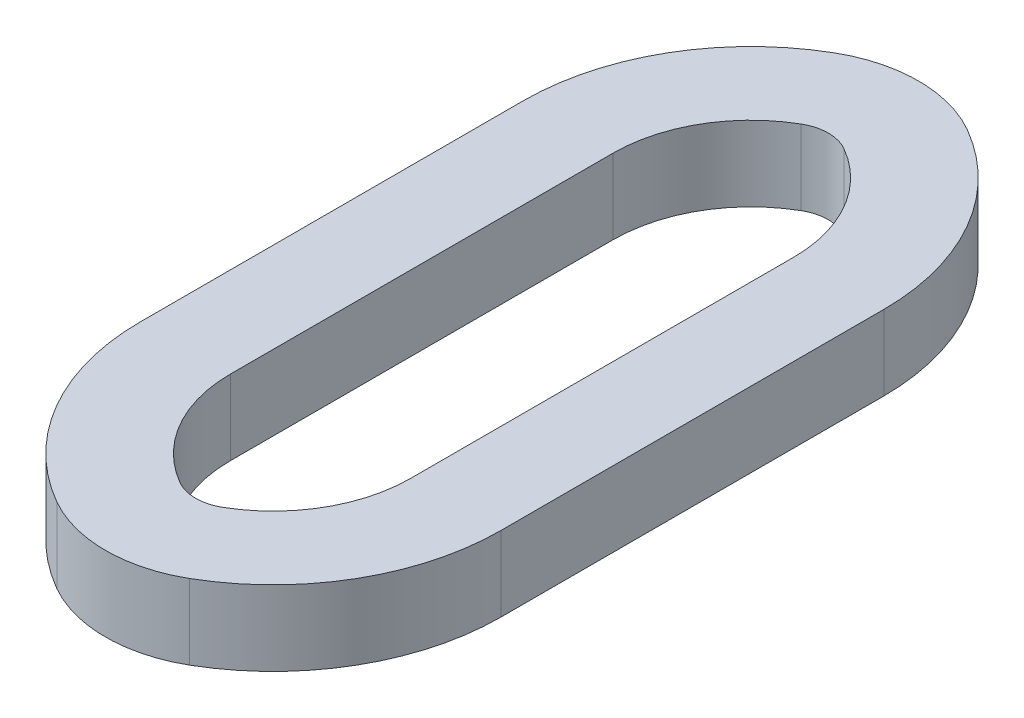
SolidWorks part; units mm, degrees
other "<6021_upper_plate>-<Fillet5>"
ref_plane "X_Y" through (0, 0, 0) normal (0, 0, 1) x (1, 0, 0)
ref_plane "Z_X" through (0, 0, 0) normal (0, 1, 0) x (1, 0, 0)
ref_plane "Y_Z" through (0, 0, 0) normal (1, 0, 0) x (0, 0, -1)
ref_plane "X_Y-6021_upper_plate" through (0, 0, 0) normal (0, 0, 1) x (1, 0, 0)
ref_plane "Z_X-6021_upper_plate" through (0, 0, 0) normal (0, 1, 0) x (1, 0, 0)
ref_plane "Y_Z-6021_upper_plate" through (0, 0, 0) normal (1, 0, 0) x (0, 0, -1)
ref_plane "X_Y-_6021_master-6021_upper_plate" through (0, 0, 0) normal (0, 0, 1) x (1, 0, 0)
ref_plane "Z_X_peltier-_6021_master-6021_upper_plate" through (0, 0, 0) normal (0, 1, 0) x (1, 0, 0)
ref_plane "Y_Z-_6021_master-6021_upper_plate" through (0, 0, 0) normal (1, 0, 0) x (0, 0, -1)
sketch "zx_sketch-_6021_master-6021_upper_plate" plane through (0, 0, 0) normal (0, 1, 0) x (1, 0, 0)
  line L0 (0, 0) -> (0, 39833.2138) construction
  line L1 (-56.5, 24.66) -> (4, 24.66)
  line L2 (-56.5, 24.66) -> (-56.5, -27)
  line L3 (-56.5, -27) -> (56.5, -27)
  line L4 (56.5, 27) -> (56.5, -27)
  line L5 (0, 0) -> (39833.2138, 0) construction
  line L6 (4, 24.66) -> (4, 27)
  line L11 (4, 27) -> (56.5, 27)
  point P3 (0, -27)
  point P17 (-22.5, 15.66)
  point P18 (22.5, 15.66)
  point P19 (22.5, -15.66)
  point P20 (-22.5, -15.66)
  dimension "D1" = 113
  dimension "D2" = 24.66
  dimension "D3" = 45
  dimension "D4" = 31.32
  dimension "D5" = 27
  dimension "D6" = 2.34
  dimension "D7" = 4
  dimension "D8" = 27
sketch "xy_sketch-_6021_master-6021_upper_plate" plane through (0, 0, 0) normal (0, 0, 1) x (1, 0, 0)
  line L0 (0, 0) -> (0, 5) construction
  line L1 (0, 5) -> (0, 7.3) construction
  dimension "D1" = 5
  dimension "D2" = 2.3
ref_plane "zx_lower_plate-_6021_master-6021_upper_plate" through (0, 5, 0) normal (0, 1, 0) x (1, 0, 0)
ref_plane "zx_sensor-_6021_master-6021_upper_plate" through (0, 7.3, 0) normal (0, 1, 0) x (1, 0, 0)
sketch "zx_sensor_sketch-_6021_master-6021_upper_plate" plane through (0, 7.3, 0) normal (0, 1, 0) x (1, 0, 0)
  line L0 (-42.2, 3.16) -> (-28.2, 8.66) construction
  line L1 (-28.2, 8.66) -> (-14.2, 3.16) construction
  line L2 (-14.2, 3.16) -> (-0.2, 8.66) construction
  line L3 (-42.2, 4.96) -> (-42.2, -0.8) construction
  line L4 (-28.2, 10.46) -> (-28.2, 4.7) construction
  line L5 (-14.2, 4.96) -> (-14.2, -0.8) construction
  line L6 (-0.2, 10.46) -> (-0.2, 4.7) construction
  line L7 (-42.2, 3.16) -> (-42.2, -0.8) construction
  line L8 (-28.2, 8.66) -> (-28.2, 4.7) construction
  line L9 (-14.2, 3.16) -> (-14.2, -0.8) construction
  line L10 (-0.2, 8.66) -> (-0.2, 4.7) construction
  line L11 (-39.215, 3.16) -> (-45.185, 3.16) construction
  line L12 (-39.215, 7.475) -> (-39.215, -1.155) construction
  line L13 (-44.615, 3.16) -> (-39.785, 3.16) construction
  point P8 (-42.2, 2.08)
  point P16 (-42.2, 3.16)
  point P19 (-39.215, 3.16)
  point P22 (-42.2, 3.16)
  dimension "D3" = 14
  dimension "D4" = 1.08
  dimension "D6" = 5.76
  dimension "D7" = 5.97
  dimension "D9" = 8.63
  dimension "D10" = 4.83
  dimension "D11" = 5.5
sketch "zx_valve_sketch-_6021_master-6021_upper_plate" plane through (0, 8.2, 0) normal (0, 1, 0) x (1, 0, 0)
  line L0 (44, -4.25) -> (34, -4.25) construction
  line L1 (34, -4.25) -> (24, -4.25) construction
  line L2 (24, -4.25) -> (14, -4.25) construction
  line L3 (44, -10.5) -> (44, -6.5) construction
  line L4 (44, -6.5) -> (44, -2.5) construction
  line L5 (34, -2.5) -> (34, -6.5) construction
  line L6 (34, -6.5) -> (34, -10.5) construction
  line L7 (24, -2.5) -> (24, -6.5) construction
  line L8 (24, -6.5) -> (24, -10.5) construction
  line L9 (14, -2.5) -> (14, -6.5) construction
  line L10 (14, -6.5) -> (14, -10.5) construction
  line L11 (44, 10.5) -> (44, -19) construction
  line L12 (34, 10.5) -> (34, -19) construction
  line L14 (24, -19) -> (24, 10.5) construction
  line L17 (14, 10.5) -> (14, -19) construction
  point P20 (44, -4.25)
  dimension "D1" = 10
  dimension "D4" = 8
  dimension "D5" = 2.25
  dimension "D6" = 29.5
sketch "zx_manifold_sketch-_6021_master-6021_upper_plate" plane through (0, 5, 0) normal (0, 1, 0) x (1, 0, 0)
  line L0 (-34.0003, 7.58) -> (-22.3997, 7.58) construction
  line L4 (44, 19.5) -> (34, 19.5) construction
  line L5 (34, 19.5) -> (24, 19.5) construction
  line L6 (24, 19.5) -> (14, 19.5) construction
  line L7 (39, 10.5) -> (39, -7.6132)
  line L9 (-48.0003, 2.08) -> (-36.3997, 2.08) construction
  line L11 (-20.0003, 2.08) -> (-8.3997, 2.08) construction
  line L12 (-6.0003, 7.58) -> (5.6003, 7.58) construction
  line L13 (-48.9, -6.72) -> (-2.2958, -6.72)
  line L15 (14, -6.5) -> (24, -6.5)
  line L17 (-14.2, 4.96) -> (-9.7626, 10.5608)
  line L22 (34, -4.7265) -> (44, -4.7265) construction
  line L23 (44, -4.7265) -> (39, -7.6132) construction
  line L24 (-4.2467, 12.0482) -> (-0.2, 10.46)
  line L26 (44, 22) -> (14, 22)
  line L28 (-48.9, -14.72) -> (-30.3969, -14.72)
  line L30 (10.8896, -9.015) -> (7.7791, -11.53) construction
  line L31 (34, -14.5) -> (45, -14.5)
  line L32 (-22.5, -24) -> (44, -24)
  line L35 (-14.2, -0.8) -> (-18.2467, -2.3882)
  line L38 (-52.7667, 2.6469) -> (-51, 17.5)
  line L39 (-28.2, 4.7) -> (-23.7626, -0.9008)
  line L40 (14, 10.5) -> (22.5, 15.66) construction
  line L43 (49, -19) -> (49, -18.5)
  line L45 (-32.2467, 12.0482) -> (-28.2, 10.46)
  line L46 (-37.7626, 10.5608) -> (-42.2, 4.96)
  line L47 (-42.2, -0.8) -> (-46.2467, -2.3882)
  line L48 (-0.2, 4.7) -> (10.8896, -9.015)
  circle A0 centre (34, 19.5) radius 3.85 construction
  circle A1 centre (44, 19.5) radius 3.85 construction
  circle A2 centre (24, 19.5) radius 3.85 construction
  circle A3 centre (14, 19.5) radius 3.85 construction
  arc A4 (34, -10.5) -> (39, -7.6132) centre (34, -4.7265) ccw
  arc A6 (29, 10.5) -> (34, -2.5) centre (48.4, 10.5) ccw
  arc A7 (44, -10.5) -> (39, -7.6132) centre (44, -4.7265) cw
  arc A8 (44, -2.5) -> (49, 10.5) centre (29.6, 10.5) ccw
  arc A11 (45.3208, 21.6226) -> (44, 22) centre (44, 19.5) ccw
  arc A12 (44, -6.5) -> (51.5, 10.5) centre (28.4833, 10.5) ccw
  arc A13 (14, 22) -> (11.6636, 20.3896) centre (14, 19.5) ccw
  arc A15 (34, -14.5) -> (34, -6.5) centre (34, -10.5) cw
  arc A16 (-48.9, -6.72) -> (-48.9, -14.72) centre (-48.9, -10.72) ccw
  arc A17 (44, -24) -> (49, -19) centre (44, -19) ccw
  arc A18 (-22.5, -24) -> (-26.4485, -19.36) centre (-22.5, -20) cw
  arc A19 (-30.3969, -14.72) -> (-26.4485, -19.36) centre (-30.3969, -18.72) cw
  arc A20 (14, -10.5) -> (10.8896, -9.015) centre (14, -6.5) cw
  arc A21 (-4.2467, 12.0482) -> (-9.7626, 10.5608) centre (-6.0003, 7.58) ccw
  circle A22 centre (-51, 17.5) radius 3.85 construction
  arc A23 (-23.7626, -0.9008) -> (-18.2467, -2.3882) centre (-20.0003, 2.08) ccw
  arc A24 (-32.2467, 12.0482) -> (-37.7626, 10.5608) centre (-34.0003, 7.58) ccw
  arc A25 (-46.2467, -2.3882) -> (-52.7667, 2.6469) centre (-48.0003, 2.08) cw
  arc A26 (49, -18.5) -> (45, -14.5) centre (45, -18.5) ccw
  circle A27 centre (-51, 17.5) radius 5.5 construction
  arc A29 (14, 19.5) -> (19, 10.5) centre (8.4, 10.5) cw
  arc A30 (39, 10.5) -> (34, 19.5) centre (28.4, 10.5) ccw
  arc A31 (49, 10.5) -> (44, 19.5) centre (38.4, 10.5) ccw
  arc A32 (29, 10.5) -> (24, 19.5) centre (18.4, 10.5) ccw
  arc A33 (19, 10.5) -> (24, -2.5) centre (38.4, 10.5) ccw
  arc A35 (45.3208, 21.6226) -> (51.5, 10.5) centre (38.4, 10.5) cw
  arc A36 (14, -2.5) -> (11.6636, 20.3896) centre (35.6147, 11.2703) cw
  arc A37 (19.5172, -12.2931) -> (7.7791, -11.53) centre (14, -6.5) cw
  arc A38 (7.7791, -11.53) -> (-2.2958, -6.72) centre (-2.2958, -19.6763) ccw
  arc A39 (24, -10.5) -> (19.5172, -12.2931) centre (24, -17) ccw
  point P73 (0, 0)
  point P75 (0, 0)
  point P107 (0, 0)
  point P121 (-42.2, 2.08)
  dimension "D1" = 30
  dimension "D2" = 7.7
  dimension "D4" = 2.5
  dimension "D5" = 4
  dimension "D6" = 92.9
  dimension "D9" = 4
  dimension "D15" = 4
  dimension "D18" = 4.8
  dimension "D11" = 4
sketch "zx_screws_sketch-_6021_master-6021_upper_plate" plane through (0, 5, 0) normal (0, 1, 0) x (1, 0, 0)
  line L4 (-34.0003, 7.58) -> (-22.3997, 7.58) construction
  line L5 (-20.0003, 2.08) -> (-8.3997, 2.08) construction
  line L6 (-6.0003, 7.58) -> (5.6003, 7.58) construction
  line L7 (-36.3997, 2.08) -> (-48.0003, 2.08) construction
  line L13 (56.5, 27) -> (56.5, -27) construction
  circle A0 centre (52.5, 23) radius 4 construction
  circle A3 centre (52.5, -23) radius 4 construction
  arc A7 (-52.7667, 2.6469) -> (-46.2467, -2.3882) centre (-48.0003, 2.08) ccw construction
  circle A8 centre (-52.5, -23) radius 4 construction
  point P0 (-0.2, -19)
  point P1 (52.5, -23)
  point P2 (52.5, 23)
  point P3 (6.6, 23)
  point P4 (-52.5, -23)
  point P5 (-42.2, 17.5)
ref_plane "yz_sensor-_6021_master-6021_upper_plate" through (-42.2, 0, 0) normal (1, 0, 0) x (0, 0, -1)
ref_plane "zx_valve-_6021_master-6021_upper_plate" through (0, 8.2, 0) normal (0, 1, 0) x (1, 0, 0)
ref_plane "zx_sensor_shelf-_6021_master-6021_upper_plate" through (0, 9.691, 0) normal (0, 1, 0) x (1, 0, 0)
sketch "Sketch7-6021_upper_plate" plane through (0, 5, 0) normal (0, 1, 0) x (1, 0, 0)
  line L6 (-56.5, -27) -> (56.5, -27)
  line L7 (56.5, 27) -> (56.5, -27)
  line L8 (4, 27) -> (56.5, 27)
  line L9 (4, 24.66) -> (4, 27)
  line L10 (-56.5, 24.66) -> (4, 24.66)
  line L11 (-56.5, 24.66) -> (-56.5, -27)
  circle A0 centre (-42.2, 4.96) radius 0.25
  circle A1 centre (-42.2, -0.8) radius 0.25
  circle A2 centre (-28.2, 10.46) radius 0.25
  circle A3 centre (-28.2, 4.7) radius 0.25
  circle A4 centre (-14.2, 4.96) radius 0.25
  circle A5 centre (-14.2, -0.8) radius 0.25
  circle A6 centre (-0.2, 10.46) radius 0.25
  circle A7 centre (-0.2, 4.7) radius 0.25
  circle A8 centre (14, -2.5) radius 0.25
  circle A9 centre (14, -6.5) radius 0.25
  circle A10 centre (14, -10.5) radius 0.25
  circle A11 centre (24, -2.5) radius 0.25
  circle A12 centre (24, -6.5) radius 0.25
  circle A13 centre (24, -10.5) radius 0.6
  circle A14 centre (34, -2.5) radius 0.25
  circle A15 centre (34, -6.5) radius 0.6
  circle A16 centre (34, -10.5) radius 0.25
  circle A17 centre (44, -2.5) radius 0.25
  circle A18 centre (44, -6.5) radius 0.25
  circle A19 centre (44, -10.5) radius 0.25
  circle A20 centre (-51, 17.5) radius 0.25
  circle A21 centre (14, 19.5) radius 0.25
  circle A22 centre (24, 19.5) radius 0.25
  circle A23 centre (34, 19.5) radius 0.25
  circle A24 centre (44, 19.5) radius 0.25
  dimension "D1" = 0.5
  dimension "D2" = 0.5
  dimension "D3" = 1.2
sketch "Sketch8-6021_upper_plate" plane through (0, 7.3, 0) normal (0, 1, 0) x (1, 0, 0)
  line L2 (14, 24) -> (44, 24)
  line L3 (14, 15) -> (44, 15)
  circle A0 centre (-51, 17.5) radius 4.5
  arc A1 (14, 24) -> (14, 15) centre (14, 19.5) ccw
  arc A2 (44, 24) -> (44, 15) centre (44, 19.5) cw
  circle A8 centre (44, 19.5) radius 0.25
  circle A9 centre (34, 19.5) radius 0.25
  circle A10 centre (24, 19.5) radius 0.25
  circle A11 centre (14, 19.5) radius 0.25
  circle A12 centre (-51, 17.5) radius 0.25
  dimension "D1" = 9
sketch "Sketch17-6021_upper_plate" plane through (0, 7.3, 0) normal (0, 1, 0) x (1, 0, 0)
  line L1 (8.5, 15) -> (49.5, 15)
  line L2 (8.5, -2.02) -> (8.5, -23.5)
  line L3 (8.5, -23.5) -> (49.5, -23.5)
  line L4 (49.5, 15) -> (49.5, -23.5)
  line L5 (-5.8, -7.52) -> (-51.3003, -7.52)
  line L6 (-51.3003, -7.52) -> (-51.3003, 14.38)
  line L7 (-51.3003, 14.38) -> (-38.2, 14.38)
  line L8 (-38.2, 14.38) -> (-38.2, 19.88)
  line L9 (-38.2, 19.88) -> (8.5, 19.88)
  line L12 (-5.8, -7.52) -> (-5.8, -2.02)
  line L13 (-5.8, -2.02) -> (8.5, -2.02)
  line L22 (4, 24.66) -> (-56.5, 24.66)
  line L23 (-56.5, 24.66) -> (-56.5, -27)
  line L24 (-56.5, -27) -> (56.5, -27)
  line L25 (56.5, -27) -> (56.5, 27)
  line L26 (56.5, 27) -> (4, 27)
  line L27 (4, 27) -> (4, 24.66)
  line L28 (-36.3997, 2.08) -> (-36.3997, 7.58) construction
  line L30 (8.5, 19.88) -> (8.5, 15)
  circle A4 centre (44, -2.5) radius 0.25
  circle A5 centre (34, -2.5) radius 0.25
  circle A6 centre (24, -2.5) radius 0.25
  circle A7 centre (14, -2.5) radius 0.25
  circle A12 centre (44, -6.5) radius 0.25
  circle A13 centre (34, -6.5) radius 0.6
  circle A14 centre (24, -6.5) radius 0.25
  circle A15 centre (14, -6.5) radius 0.25
  circle A20 centre (44, -10.5) radius 0.25
  circle A21 centre (34, -10.5) radius 0.25
  circle A22 centre (24, -10.5) radius 0.6
  circle A23 centre (14, -10.5) radius 0.25
  circle A32 centre (44, 19.5) radius 0.25
  circle A33 centre (34, 19.5) radius 0.25
  circle A34 centre (24, 19.5) radius 0.25
  circle A35 centre (14, 19.5) radius 0.25
  circle A36 centre (-51, 17.5) radius 0.25
  point P51 (29, -23.5)
  point P64 (49.5, -4.25)
  dimension "D1" = 38.5
  dimension "D2" = 41
sketch "Sketch15-6021_upper_plate" plane through (0, 7.3, 0) normal (0, 1, 0) x (1, 0, 0)
  line L2 (-46.025, 2.08) -> (-45.0281, 2.08) construction
  line L7 (-41.25, 4.094) -> (-41.25, 0.066)
  line L8 (-43.15, 4.094) -> (-43.15, 0.066)
  line L9 (-42.7, 4.094) -> (-42.2, 4.96) construction
  line L10 (-42.2, 4.96) -> (-42.45, 4.96) construction
  arc A0 (-42.425, 5.3497) -> (-41.975, 5.3497) centre (-42.2, 4.96) cw
  arc A2 (-42.425, 5.3497) -> (-43.15, 4.094) centre (-41.7, 4.094) ccw
  arc A3 (-41.975, 5.3497) -> (-41.25, 4.094) centre (-42.7, 4.094) cw
  arc A4 (-41.975, -1.1897) -> (-41.25, 0.066) centre (-42.7, 0.066) ccw
  arc A5 (-42.425, -1.1897) -> (-43.15, 0.066) centre (-41.7, 0.066) cw
  arc A6 (-42.425, -1.1897) -> (-41.975, -1.1897) centre (-42.2, -0.8) ccw
  point P12 (-42.2, 2.08)
  dimension "D1" = 1.9
  dimension "D2" = 60
sketch "Sketch16-6021_upper_plate" plane through (0, 7.3, 0) normal (0, 1, 0) x (1, 0, 0)
  line L8 (-41.25, 0.066) -> (-41.25, 4.094)
  line L9 (-43.15, 4.094) -> (-43.15, 0.066)
  line L66 (-39.75, 0.066) -> (-39.75, 4.094)
  line L67 (-44.65, 4.094) -> (-44.65, 0.066)
  arc A11 (-42.425, -1.1897) -> (-41.975, -1.1897) centre (-42.2, -0.8) ccw
  arc A24 (-41.25, 4.094) -> (-41.975, 5.3497) centre (-42.7, 4.094) ccw
  arc A25 (-41.975, -1.1897) -> (-41.25, 0.066) centre (-42.7, 0.066) ccw
  arc A27 (-43.15, 0.066) -> (-42.425, -1.1897) centre (-41.7, 0.066) ccw
  arc A28 (-42.425, 5.3497) -> (-43.15, 4.094) centre (-41.7, 4.094) ccw
  arc A35 (-43.175, -2.4887) -> (-41.225, -2.4887) centre (-42.2, -0.8) ccw
  arc A36 (-39.75, 4.094) -> (-41.225, 6.6487) centre (-42.7, 4.094) ccw
  arc A37 (-41.225, -2.4887) -> (-39.75, 0.066) centre (-42.7, 0.066) ccw
  arc A39 (-44.65, 0.066) -> (-43.175, -2.4887) centre (-41.7, 0.066) ccw
  arc A40 (-43.175, 6.6487) -> (-44.65, 4.094) centre (-41.7, 4.094) ccw
  arc A45 (-41.225, 6.6487) -> (-43.175, 6.6487) centre (-42.2, 4.96) ccw
  arc A47 (-41.975, 5.3497) -> (-42.425, 5.3497) centre (-42.2, 4.96) ccw
sketch "text-6021_upper_plate" plane through (0, 7.3, 0) normal (0, 1, 0) x (1, 0, 0)
  line L1 (14, -976.24) -> (14, 49023.76) construction
  line L2 (24, -976.24) -> (24, 49023.76) construction
  line L3 (34, -976.24) -> (34, 49023.76) construction
  line L4 (44, -976.24) -> (44, 49023.76) construction
  line L5 (-51, -983.5) -> (-51, 49016.5) construction
  text T0 "O" font "Verdana" height 1.8
  text T1 "R" font "Verdana" height 1.8
  text T2 "W" font "Verdana" height 1.8
  text T3 "B" font "Verdana" height 1.8
  text T4 "I" font "Segoe UI" height 1.8
sketch "xz_cover-_6021_master-6021_upper_plate" plane through (0, 0, 0) normal (0, 1, 0) x (1, 0, 0)
  line L1 (-63, -36.79) -> (63, -36.79)
  line L2 (-71.85, -27.94) -> (-71.85, 30.02)
  line L3 (-71.85, 30.02) -> (71.85, 30.02)
  line L4 (71.85, -27.94) -> (71.85, 30.02)
  line L5 (-71.85, -36.79) -> (71.85, 30.02) construction
  line L6 (-71.85, 30.02) -> (71.85, -36.79) construction
  line L7 (0, -1003.385) -> (0, 48996.615) construction
  arc A0 (71.85, -27.94) -> (63, -36.79) centre (63, -27.94) cw
  arc A1 (-63, -36.79) -> (-71.85, -27.94) centre (-63, -27.94) cw
  circle A2 centre (-64.495, 5.21) radius 3.6
  circle A3 centre (64.495, 5.21) radius 3.6
  point P0 (0, -3.385)
  dimension "D4" = 8.85
  dimension "D5" = 42
  dimension "D7" = 7.2
  dimension "D1" = 66.81
  dimension "D2" = 143.7
  dimension "D6" = 128.99
sketch "Sketch20-6021_upper_plate" plane through (0, 5, 0) normal (0, -1, 0) x (1, 0, 0)
  line L3 (10.6952, 9.1722) -> (-0.3944, -4.5428)
  line L6 (-42.396, -5.1152) -> (-37.9586, -10.716)
  line L7 (-32.1553, -12.2809) -> (-28.1087, -10.6927)
  line L10 (-42.004, -4.8048) -> (-37.5667, -10.4055)
  line L11 (-32.338, -11.8155) -> (-28.2913, -10.2273)
  line L13 (11.084, 8.8578) -> (-0.0056, -4.8572)
  line L16 (-18.338, 2.1555) -> (-14.2913, 0.5673)
  line L17 (-28.004, -4.8552) -> (-23.5667, 0.7455)
  line L20 (-18.1553, 2.6209) -> (-14.1087, 1.0327)
  line L21 (-28.396, -4.5448) -> (-23.9586, 1.056)
  line L23 (-42.396, -5.1152) -> (-42.004, -4.8048)
  line L26 (-4.1553, -12.2809) -> (-0.1087, -10.6927)
  line L27 (-14.396, -5.1152) -> (-9.9586, -10.716)
  line L30 (-4.338, -11.8155) -> (-0.2913, -10.2273)
  line L31 (-14.004, -4.8048) -> (-9.5667, -10.4055)
  line L36 (-28.1087, -10.6927) -> (-28.2913, -10.2273)
  line L37 (-28.004, -4.8552) -> (-28.396, -4.5448)
  line L38 (-14.2913, 0.5673) -> (-14.1087, 1.0327)
  line L39 (-14.396, -5.1152) -> (-14.004, -4.8048)
  line L40 (-0.1087, -10.6927) -> (-0.2913, -10.2273)
  line L41 (-0.0056, -4.8572) -> (-0.3944, -4.5428)
  line L42 (14, 10.25) -> (14, 10.75)
  arc A3 (-37.9586, -10.716) -> (-32.1553, -12.2809) centre (-34.0003, -7.58) ccw
  arc A5 (-37.5667, -10.4055) -> (-32.338, -11.8155) centre (-34.0003, -7.58) ccw
  arc A8 (-18.338, 2.1555) -> (-23.5667, 0.7455) centre (-20.0003, -2.08) ccw
  arc A10 (-18.1553, 2.6209) -> (-23.9586, 1.056) centre (-20.0003, -2.08) ccw
  arc A13 (-9.9586, -10.716) -> (-4.1553, -12.2809) centre (-6.0003, -7.58) ccw
  arc A15 (-9.5667, -10.4055) -> (-4.338, -11.8155) centre (-6.0003, -7.58) ccw
  arc A16 (14, 10.75) -> (10.6952, 9.1722) centre (14, 6.5) ccw
  arc A19 (14, 10.25) -> (11.084, 8.8578) centre (14, 6.5) ccw
sketch "Sketch21-6021_upper_plate" plane through (0, 5, 0) normal (0, -1, 0) x (1, 0, 0)
  line L2 (14, 6.25) -> (24, 6.25)
  line L3 (14, 6.25) -> (14, 6.75)
  line L6 (-53.015, -2.6765) -> (-51.2483, -17.5295)
  line L7 (-42.1087, 1.0327) -> (-46.1553, 2.6209)
  line L10 (-52.5185, -2.6174) -> (-50.7517, -17.4705)
  line L11 (-42.2913, 0.5673) -> (-46.338, 2.1555)
  line L12 (14, 6.75) -> (24, 6.75)
  line L13 (24, 6.25) -> (24, 6.75)
  line L22 (-51.2483, -17.5295) -> (-50.7517, -17.4705)
  line L24 (39.25, -10.5) -> (39.25, 7.5455)
  line L26 (38.75, -10.5) -> (38.75, 7.5455)
  line L28 (13.7892, 2.6343) -> (14.2108, 2.3657)
  line L29 (14.1321, -19.7123) -> (13.8679, -19.2877)
  line L30 (23.8144, 2.6675) -> (24.1856, 2.3325)
  line L31 (34.1856, 2.3325) -> (33.8144, 2.6675)
  line L32 (24.1321, -19.7123) -> (23.8679, -19.2877)
  line L33 (34.1321, -19.7123) -> (33.8679, -19.2877)
  line L34 (44.1321, -19.7123) -> (43.8679, -19.2877)
  line L35 (34, 10.25) -> (34, 10.75)
  line L36 (44, 10.25) -> (44, 10.75)
  line L38 (43.8144, 2.3325) -> (44.1856, 2.6675)
  line L41 (44.1685, 6.6846) -> (43.8315, 6.3154)
  line L44 (14, -22.25) -> (44, -22.25)
  line L46 (14, -21.75) -> (44, -21.75)
  arc A3 (-46.1553, 2.6209) -> (-53.015, -2.6765) centre (-48.0003, -2.08) ccw
  arc A5 (-46.338, 2.1555) -> (-52.5185, -2.6174) centre (-48.0003, -2.08) ccw
  arc A41 (24.1856, 2.3325) -> (19.25, -10.5) centre (38.4, -10.5) ccw
  arc A42 (14.1321, -19.7123) -> (19.25, -10.5) centre (8.4, -10.5) ccw
  arc A45 (23.8144, 2.6675) -> (18.75, -10.5) centre (38.4, -10.5) ccw
  arc A46 (13.8679, -19.2877) -> (18.75, -10.5) centre (8.4, -10.5) ccw
  arc A48 (39, 8.0855) -> (34, 10.75) centre (34, 4.7265) ccw
  arc A51 (23.8679, -19.2877) -> (28.75, -10.5) centre (18.4, -10.5) ccw
  arc A52 (33.8144, 2.6675) -> (28.75, -10.5) centre (48.4, -10.5) ccw
  arc A55 (24.1321, -19.7123) -> (29.25, -10.5) centre (18.4, -10.5) ccw
  arc A56 (34.1856, 2.3325) -> (29.25, -10.5) centre (48.4, -10.5) ccw
  arc A57 (38.75, 7.5455) -> (34, 10.25) centre (34, 4.7265) ccw
  arc A64 (44, 10.25) -> (39.25, 7.5455) centre (44, 4.7265) ccw
  arc A65 (34.1321, -19.7123) -> (39.25, -10.5) centre (28.4, -10.5) ccw
  arc A68 (44, 10.75) -> (39, 8.0855) centre (44, 4.7265) ccw
  arc A69 (33.8679, -19.2877) -> (38.75, -10.5) centre (28.4, -10.5) ccw
  arc A75 (-42.2913, 0.5673) -> (-42.1087, 1.0327) centre (-42.2, 0.8) ccw
  arc A79 (44.1321, -19.7123) -> (49.25, -10.5) centre (38.4, -10.5) ccw
  arc A80 (49.25, -10.5) -> (44.1856, 2.6675) centre (29.6, -10.5) ccw
  arc A83 (43.8679, -19.2877) -> (48.75, -10.5) centre (38.4, -10.5) ccw
  arc A84 (48.75, -10.5) -> (43.8144, 2.3325) centre (29.6, -10.5) ccw
  arc A87 (51.75, -10.5) -> (44.1685, 6.6846) centre (28.4833, -10.5) ccw
  arc A88 (45.4528, -21.8349) -> (51.75, -10.5) centre (38.4, -10.5) ccw
  arc A89 (44, -22.25) -> (45.4528, -21.8349) centre (44, -19.5) ccw
  arc A90 (11.43, -20.4785) -> (14, -22.25) centre (14, -19.5) ccw
  arc A91 (13.7892, 2.6343) -> (11.43, -20.4785) centre (35.6147, -11.2703) ccw
  arc A97 (51.25, -10.5) -> (43.8315, 6.3154) centre (28.4833, -10.5) ccw
  arc A98 (45.1887, -21.4104) -> (51.25, -10.5) centre (38.4, -10.5) ccw
  arc A99 (44, -21.75) -> (45.1887, -21.4104) centre (44, -19.5) ccw
  arc A100 (11.8973, -20.3006) -> (14, -21.75) centre (14, -19.5) ccw
  arc A101 (14.2108, 2.3657) -> (11.8973, -20.3006) centre (35.6147, -11.2703) ccw
sketch "Sketch22-6021_upper_plate" plane through (0, 5, 0) normal (0, -1, 0) x (1, 0, 0)
  line L44 (45, 15.1) -> (34, 15.1)
  line L45 (48.4, 19) -> (48.4, 18.5)
  line L46 (-22.5, 23.4) -> (44, 23.4)
  line L47 (-48.9, 14.12) -> (-30.3969, 14.12)
  line L48 (-2.2958, 7.32) -> (-48.9, 7.32)
  line L56 (24, 9.9) -> (24, 11.1)
  line L57 (34, 5.9) -> (34, 7.1)
  line L68 (45, 13.9) -> (34, 13.9)
  line L69 (49.6, 19) -> (49.6, 18.5)
  line L70 (-22.5, 24.6) -> (44, 24.6)
  line L71 (-48.9, 15.32) -> (-30.3969, 15.32)
  line L72 (-2.2958, 6.12) -> (-48.9, 6.12)
  arc A0 (19.931, 12.7276) -> (24, 11.1) centre (24, 17) ccw
  arc A1 (19.1034, 11.8586) -> (24, 9.9) centre (24, 17) ccw
  arc A78 (34, 15.1) -> (34, 5.9) centre (34, 10.5) ccw
  arc A79 (45, 15.1) -> (48.4, 18.5) centre (45, 18.5) ccw
  arc A80 (48.4, 19) -> (44, 23.4) centre (44, 19) ccw
  arc A81 (-22.5, 23.4) -> (-25.8562, 19.456) centre (-22.5, 20) ccw
  arc A82 (-30.3969, 14.12) -> (-25.8562, 19.456) centre (-30.3969, 18.72) ccw
  arc A83 (-48.9, 14.12) -> (-48.9, 7.32) centre (-48.9, 10.72) ccw
  arc A84 (-2.2958, 7.32) -> (7.3126, 11.9073) centre (-2.2958, 19.6763) ccw
  arc A85 (19.931, 12.7276) -> (7.3126, 11.9073) centre (14, 6.5) ccw
  arc A96 (34, 13.9) -> (34, 7.1) centre (34, 10.5) ccw
  arc A97 (45, 13.9) -> (49.6, 18.5) centre (45, 18.5) ccw
  arc A98 (49.6, 19) -> (44, 24.6) centre (44, 19) ccw
  arc A99 (-22.5, 24.6) -> (-27.0407, 19.264) centre (-22.5, 20) ccw
  arc A100 (-30.3969, 15.32) -> (-27.0407, 19.264) centre (-30.3969, 18.72) ccw
  arc A101 (-48.9, 15.32) -> (-48.9, 6.12) centre (-48.9, 10.72) ccw
  arc A102 (-2.2958, 6.12) -> (8.2457, 11.1528) centre (-2.2958, 19.6763) ccw
  arc A103 (19.1034, 11.8586) -> (8.2457, 11.1528) centre (14, 6.5) ccw
  point P7 (0, 0)
  point P8 (0, 0)
sketch "Sketch29-6021_upper_plate" plane through (0, 7.3, 0) normal (0, 1, 0) x (1, 0, 0)
  line L4 (8.5, 15) -> (8.5, -23.5)
  line L5 (8.5, -23.5) -> (49.5, -23.5)
  line L6 (49.5, 15) -> (49.5, -23.5)
  line L7 (8.5, 15) -> (49.5, 15)
sketch "Sketch30-6021_upper_plate" plane through (0, 7, 0) normal (0, 1, 0) x (1, 0, 0)
  line L0 (47.7322, 13.2322) -> (49.5, 13.2322) construction
  line L2 (49.5, 15) -> (49.5, 13.2322) construction
  circle A0 centre (47.7322, 13.2322) radius 2.5
  circle A1 centre (47.7322, -21.7322) radius 2.5
  circle A2 centre (10.2678, -21.7322) radius 2.5
  circle A3 centre (8.5, 12.5) radius 2.5
  dimension "D1" = 5
inserted part "6021_upper_plate"
sketch "Sketch13" plane through (0, 6.7, 0) normal (0, 1, 0) x (1, 0, 0)
  line L4 (-44.1, 4.094) -> (-44.1, 0.066)
  line L5 (-40.3, 0.066) -> (-40.3, 4.094)
  line L6 (-44.1, 4.094) -> (-44.1, 0.066)
  line L7 (-40.3, 0.066) -> (-40.3, 4.094)
  line L9 (-41.25, 0.066) -> (-41.25, 4.094)
  line L10 (-41.25, 0.066) -> (-41.25, 4.094)
  line L11 (-43.15, 4.094) -> (-43.15, 0.066)
  line L12 (-43.15, 4.094) -> (-43.15, 0.066)
  arc A6 (-41.5, 6.1724) -> (-42.9, 6.1724) centre (-42.2, 4.96) ccw
  arc A7 (-41.5, 6.1724) -> (-42.9, 6.1724) centre (-42.2, 4.96) ccw
  arc A8 (-42.9, -2.0124) -> (-41.5, -2.0124) centre (-42.2, -0.8) ccw
  arc A9 (-42.9, -2.0124) -> (-41.5, -2.0124) centre (-42.2, -0.8) ccw
  arc A10 (-41.975, 5.3497) -> (-42.425, 5.3497) centre (-42.2, 4.96) ccw
  arc A11 (-41.975, 5.3497) -> (-42.425, 5.3497) centre (-42.2, 4.96) ccw
  arc A12 (-40.3, 4.094) -> (-41.5, 6.1724) centre (-42.7, 4.094) ccw
  arc A13 (-41.25, 4.094) -> (-41.975, 5.3497) centre (-42.7, 4.094) ccw
  arc A14 (-42.9, 6.1724) -> (-44.1, 4.094) centre (-41.7, 4.094) ccw
  arc A15 (-44.1, 0.066) -> (-42.9, -2.0124) centre (-41.7, 0.066) ccw
  arc A16 (-41.25, 4.094) -> (-41.975, 5.3497) centre (-42.7, 4.094) ccw
  arc A17 (-41.5, -2.0124) -> (-40.3, 0.066) centre (-42.7, 0.066) ccw
  arc A18 (-40.3, 4.094) -> (-41.5, 6.1724) centre (-42.7, 4.094) ccw
  arc A20 (-42.9, 6.1724) -> (-44.1, 4.094) centre (-41.7, 4.094) ccw
  arc A21 (-44.1, 0.066) -> (-42.9, -2.0124) centre (-41.7, 0.066) ccw
  arc A23 (-41.5, -2.0124) -> (-40.3, 0.066) centre (-42.7, 0.066) ccw
  arc A24 (-41.975, -1.1897) -> (-41.25, 0.066) centre (-42.7, 0.066) ccw
  arc A25 (-41.975, -1.1897) -> (-41.25, 0.066) centre (-42.7, 0.066) ccw
  arc A26 (-42.425, -1.1897) -> (-41.975, -1.1897) centre (-42.2, -0.8) ccw
  arc A27 (-42.425, -1.1897) -> (-41.975, -1.1897) centre (-42.2, -0.8) ccw
  arc A28 (-43.15, 0.066) -> (-42.425, -1.1897) centre (-41.7, 0.066) ccw
  arc A29 (-43.15, 0.066) -> (-42.425, -1.1897) centre (-41.7, 0.066) ccw
  arc A30 (-42.425, 5.3497) -> (-43.15, 4.094) centre (-41.7, 4.094) ccw
  arc A31 (-42.425, 5.3497) -> (-43.15, 4.094) centre (-41.7, 4.094) ccw
  dimension "D1" = 0.55
  dimension "D3" = 0
extrude "Boss-Extrude1" add sketch "Sketch13" along normal blind 0.79 separate body
delete or keep bodies "Body-Delete/Keep 1" type delete bodies bodies 101
